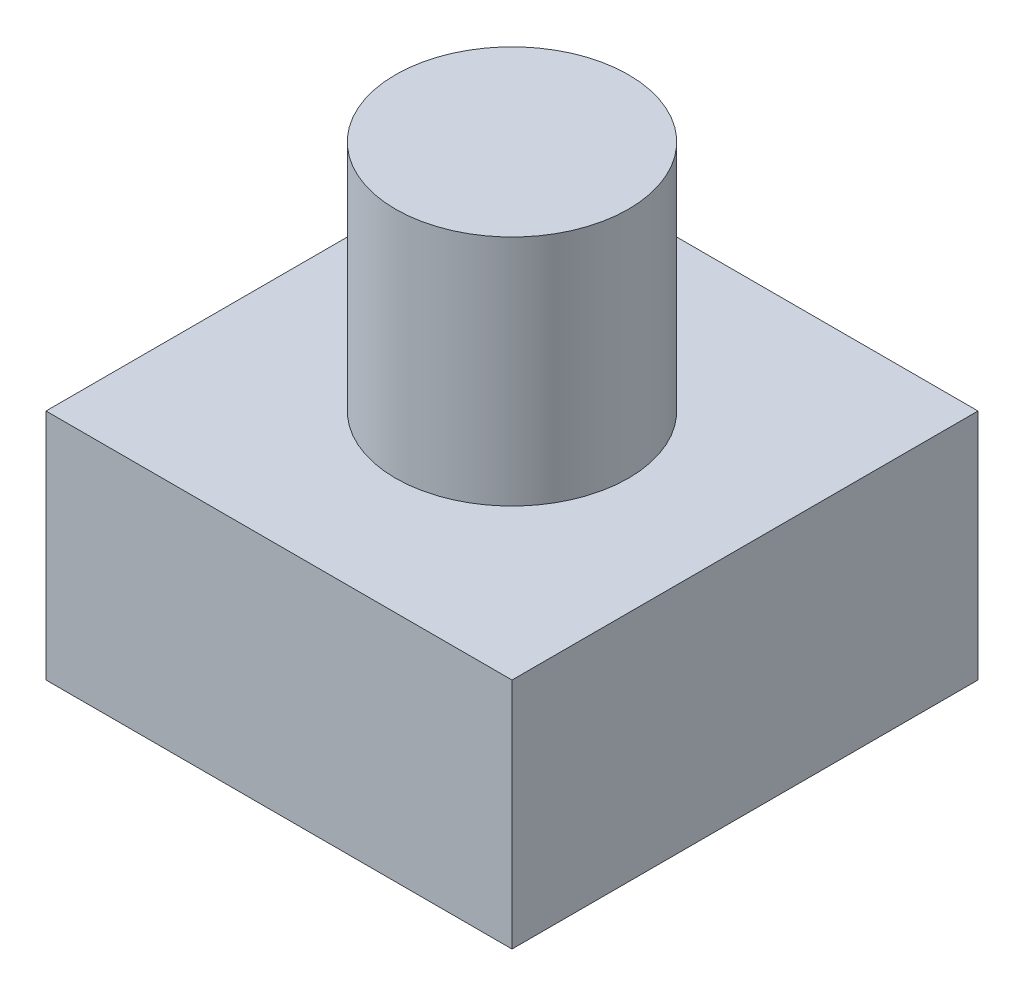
SolidWorks part; units mm, degrees
ref_plane "Front Plane" through (0, 0, 0) normal (0, 0, 1) x (1, 0, 0)
ref_plane "Top Plane" through (0, 0, 0) normal (0, 1, 0) x (1, 0, 0)
ref_plane "Right Plane" through (0, 0, 0) normal (1, 0, 0) x (0, 0, -1)
sketch "Sketch1" plane through (0, 0, 0) normal (0, 1, 0) x (1, 0, 0)
  line L1 (0, 0) -> (-100, 0)
  line L2 (0, 0) -> (0, 100)
  line L3 (0, 100) -> (-100, 100)
  line L4 (-100, 0) -> (-100, 100)
  dimension "D1" = 100
  dimension "D2" = 100
extrude "Extrude1" add sketch "Sketch1" along normal blind 50
sketch "Sketch2" plane through (0, 50, 0) normal (0, 1, 0) x (-1, 0, 0)
  line L0 (50, -100) -> (50, 0) construction
  line L1 (0, -100) -> (100, -100) construction
  line L2 (100, 0) -> (0, 0) construction
  circle A0 centre (50, -50) radius 25
  dimension "D1" = 50
extrude "Extrude2" add sketch "Sketch2" along normal blind 50
